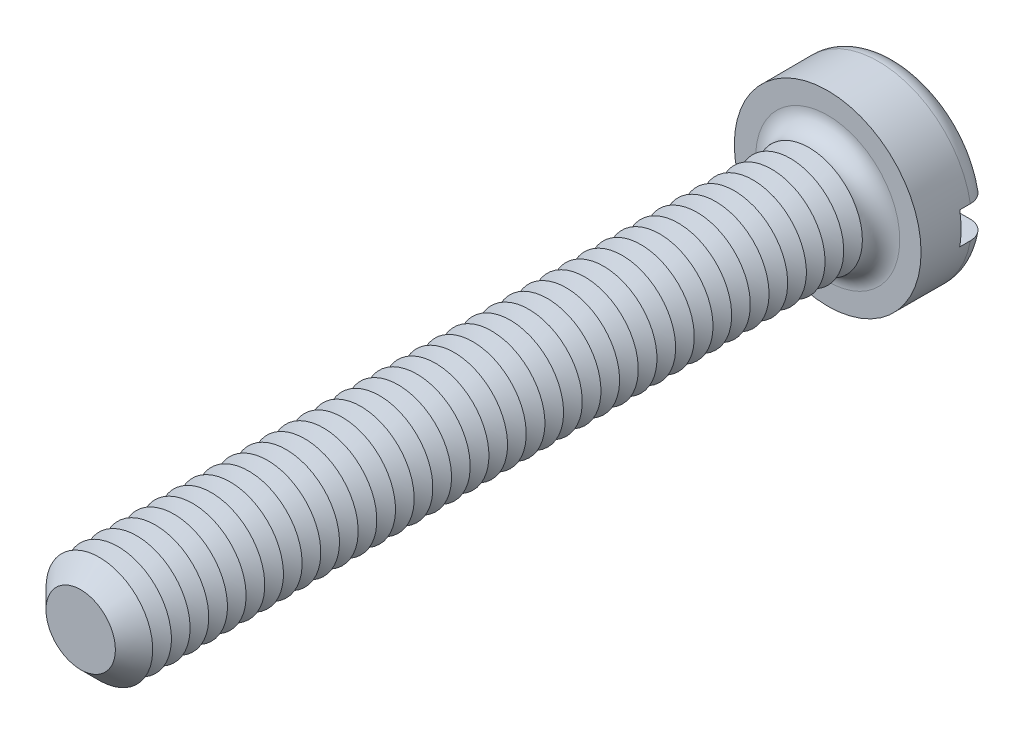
SolidWorks part; units mm, degrees
ref_plane "Front Plane" through (0, 0, 0) normal (0, 0, 1) x (1, 0, 0)
ref_plane "Top Plane" through (0, 0, 0) normal (0, 1, 0) x (1, 0, 0)
ref_plane "Right Plane" through (0, 0, 0) normal (1, 0, 0) x (0, 0, -1)
sketch "Sketch3" plane through (0, 0, 0) normal (0, 0, 1) x (1, 0, 0)
  circle A0 centre (0, 0) radius 3.5
  dimension "D1" = 7
extrude "Boss-Extrude2" add sketch "Sketch3" against normal blind 2.6
sketch "Sketch4" plane through (0, 0, 0) normal (0, 0, 1) x (1, 0, 0)
  circle A0 centre (0, 0) radius 2
  dimension "D1" = 4
extrude "Boss-Extrude3" add sketch "Sketch4" along normal blind 28
fillet "Fillet1" radius 0.7 2 edges at (3.5, 0, -2.6) (2, 0, 0)
chamfer "Chamfer1" distance 0.7 angle 45 1 edges at (2, 0, 28)
sketch "Sketch5" plane through (0, 0, 0) normal (1, 0, 0) x (0, 0, -1)
  line L0 (1.6944, 0) -> (-7.6738, 0) construction
sketch "Sketch6" plane through (0, 0, 0) normal (1, 0, 0) x (0, 0, -1)
  line L0 (-0.7, 2) -> (-1.05, 1.3938)
  line L1 (-1.05, 1.3938) -> (-1.4, 2)
  line L2 (-0.7, 2) -> (-27.3, 2) construction
  line L3 (-1.4, 2) -> (-0.7, 2)
  dimension "D1" = 0.7
revolve "Cut-Revolve1" cut sketch "Sketch6" angle 360 about L0
pattern_linear "LPattern1" count 38 spacing 0.7 along (0, 0, 1) of "Cut-Revolve1"
sketch "Sketch8" plane through (0, 0, -2.6) normal (0, 0, -1) x (-1, 0, 0)
  line L1 (3.5, -0.6) -> (-3.5, -0.6)
  line L2 (3.5, -0.6) -> (3.5, 0.6)
  line L3 (3.5, 0.6) -> (-3.5, 0.6)
  line L4 (-3.5, -0.6) -> (-3.5, 0.6)
  line L5 (3.5, -0.6) -> (-3.5, 0.6) construction
  line L6 (3.5, 0.6) -> (-3.5, -0.6) construction
  point P0 (0, 0)
  dimension "D1" = 7
  dimension "D2" = 1.2
extrude "Cut-Extrude1" cut sketch "Sketch8" against normal blind 1.1
